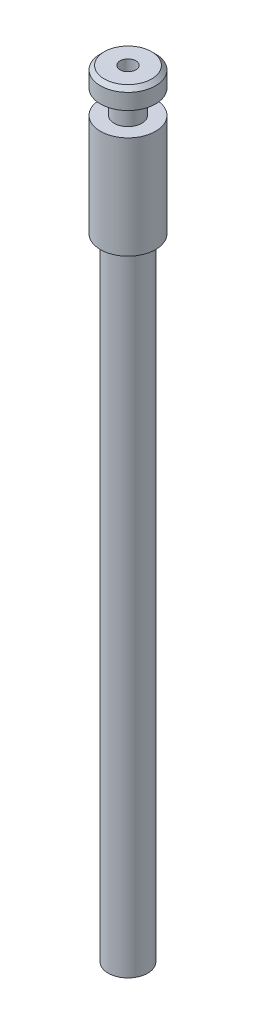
SolidWorks part; units mm, degrees
ref_plane "Plan de face" through (0, 0, 0) normal (0, 0, 1) x (1, 0, 0)
ref_plane "Plan de dessus" through (0, 0, 0) normal (0, 1, 0) x (1, 0, 0)
ref_plane "Plan de droite" through (0, 0, 0) normal (1, 0, 0) x (0, 0, -1)
sketch "Esquisse1" plane through (0, 0, 0) normal (0, 1, 0) x (1, 0, 0)
  circle A0 centre (0, 0) radius 3.5
  dimension "D1" = 7
extrude "Boss.-Extru.1" add sketch "Esquisse1" along normal blind 2.5
chamfer "Chanfrein1" distance 0.5 angle 45 1 edges at (0, 2.5, 3.5)
sketch "Esquisse2" plane through (0, 0, 0) normal (0, -1, 0) x (1, 0, 0)
  circle A0 centre (0, 0) radius 1.75
  dimension "D1" = 3.5
extrude "Boss.-Extru.2" add sketch "Esquisse2" along normal blind 3
sketch "Esquisse3" plane through (0, -3, 0) normal (0, -1, 0) x (1, 0, 0)
  circle A0 centre (0, 0) radius 3.5 construction
  circle A1 centre (0, 0) radius 3.5
extrude "Boss.-Extru.3" add sketch "Esquisse3" along normal blind 13
sketch "Esquisse6" plane through (0, -16, 0) normal (0, -1, 0) x (1, 0, 0)
  circle A0 centre (0, 0) radius 2.5
  dimension "D1" = 5
extrude "Boss.-Extru.5" add sketch "Esquisse6" along normal blind 80
sketch "Esquisse4" plane through (0, 2.5, 0) normal (0, 1, 0) x (1, 0, 0)
  circle A0 centre (0, 0) radius 1
  dimension "D1" = 2
extrude "Enlèv. mat.-Extru.2" cut sketch "Esquisse4" against normal through all
